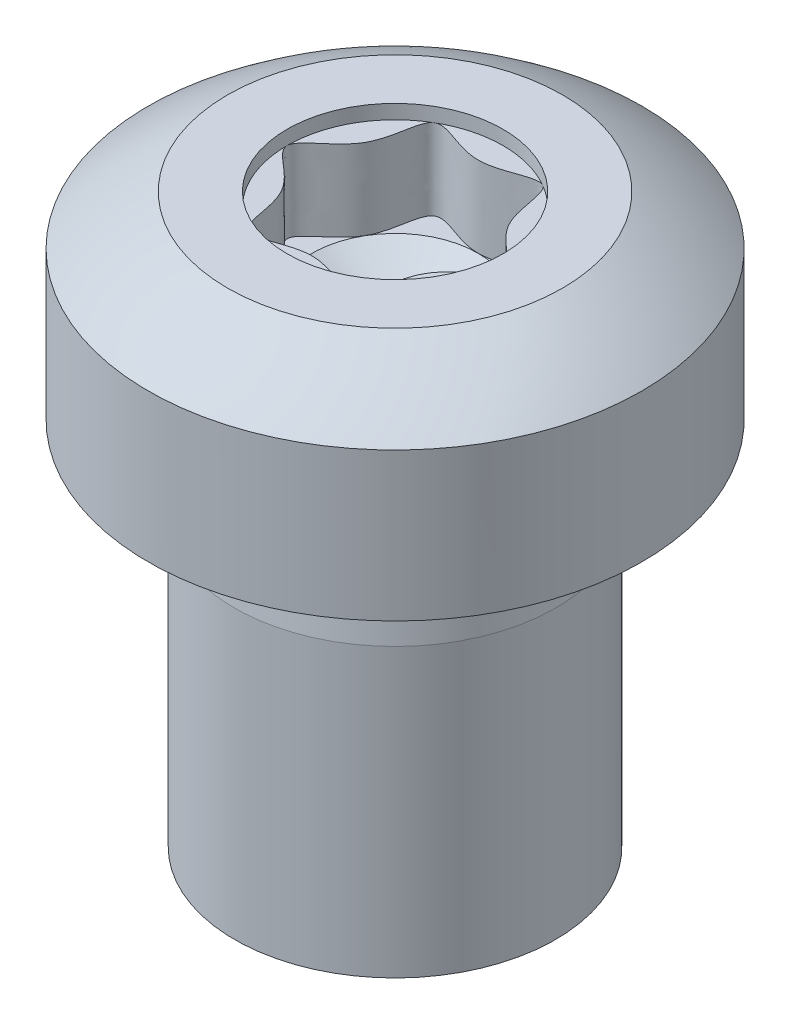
SolidWorks part; units mm, degrees
ref_plane "Front" through (0, 0, 0) normal (0, 0, 1) x (1, 0, 0)
ref_plane "Top" through (0, 0, 0) normal (0, 1, 0) x (1, 0, 0)
ref_plane "Right" through (0, 0, 0) normal (1, 0, 0) x (0, 0, -1)
sketch "Sketch1" plane through (0, 0, 0) normal (0, 0, 1) x (1, 0, 0)
  line L0 (0, 0) -> (0, 34.6184) construction
  line L1 (0, 0) -> (1.3, 0)
  line L2 (1.3, 0) -> (1.3, 3)
  line L3 (1.3, 3) -> (2, 3)
  line L4 (2, 3) -> (2, 4.6)
  line L5 (2, 4.6) -> (0, 4.6)
  line L6 (0, 4.6) -> (0, 0)
  line L7 (2, 3) -> (2.4, 3) construction
  line L8 (2.4, 3) -> (2.4, 0.8) construction
  dimension "HEAD_DIA" = 4
  dimension "HEAD_HT" = 1.6
  dimension "LENGTH" = 3
  dimension "DIA" = 2.6
  dimension "pitch" = 0.4
  dimension "thread_length" = 2.2
revolve "BODY" add sketch "Sketch1" angle 360 about L0
sketch "Sketch2" plane through (0, 0, 0) normal (0, 0, 1) x (1, 0, 0)
  line L0 (2, 4.2) -> (0, 1.702) construction
  line L3 (2, 3) -> (2, 4.6) construction
  line L4 (0, 0) -> (0, 34.6184) construction
  line L5 (0, 4.902) -> (0, 5.3842)
  line L6 (3.2, 1.702) -> (3.2, 5.3842)
  line L7 (3.2, 5.3842) -> (0, 5.3842)
  line L8 (0, 5.3842) -> (3.2, 5.3842)
  arc A0 (3.2, 1.702) -> (0, 4.902) centre (0, 1.702) ccw
  dimension "D1" = 0.4
  dimension "SPHERE_DIA" = 3.2
  dimension "D2" = 0.4822
revolve "HEAD-CUT" cut sketch "Sketch2" angle 360 about axis through (0, 0, 0) along (0, 1, 0)
sketch "Sketch4" plane through (0, 0, 0) normal (0, 0, 1) x (1, 0, 0)
  line L0 (-1.3, 2.3264) -> (-1.2436, 2.9)
  line L1 (-1.3, 3) -> (-1.3, 0) construction
  line L2 (-1.3, 3) -> (-1.3, 2.3264)
  arc A0 (-1.2436, 2.9) -> (-1.3, 3) centre (-1.3431, 2.9098) ccw
  dimension "D1" = 0.1
  dimension "CONER_RAD" = 0.1
  dimension "GAP" = 0.6736
revolve "GAP" cut sketch "Sketch4" angle 360 about axis through (0, 0, 0) along (0, 1, 0)
sketch "Sketch5" plane through (0, 4.6, 0) normal (0, 1, 0) x (-1, 0, 0)
  line L0 (0, 0.6731) -> (0, 0) construction
  line L1 (0, 0) -> (0.4375, 0.7578) construction
  circle A0 centre (0, 0) radius 0.6731 construction
  circle A1 centre (0, 0) radius 0.875
  spline S0 degree 3 poles (0, 0.5431) (0.5387, 0.933) (0.4704, 0.2716) (1.0773, 0) (0.4704, -0.2716) (0.5387, -0.933) (0, -0.5431) (-0.5387, -0.933) (-0.4704, -0.2716) (-1.0773, 0) (-0.4704, 0.2716) (-0.5387, 0.933) (0, 0.5431) (0.5387, 0.933) (0.4704, 0.2716) knots -0.25 -0.166667 -0.083333 0 0.083333 0.166667 0.25 0.333333 0.416667 0.5 0.583333 0.666667 0.75 0.833333 0.916667 1 1.083333 1.166667 1.25 only from (0.4375, 0.7578) to (0.4375, 0.7578)
  point P4 (0, 0.6731)
  point P5 (0.4375, 0.7578)
  point P9 (0.875, 0)
  point P10 (0.5829, 0.3365)
  point P11 (0.5829, -0.3365)
  point P12 (0, -0.6731)
  point P13 (-0.5829, -0.3365)
  point P14 (-0.5829, 0.3365)
  point P15 (0.4375, -0.7578)
  point P16 (-0.4375, -0.7578)
  point P19 (-0.875, 0)
  point P20 (-0.4375, 0.7578)
  dimension "slot_dia" = 1.75
  dimension "D3" = 1.3462
  dimension "D1" = 30
extrude "Recess-Cut-Extrude1" cut sketch "Sketch5" against normal blind 0.77
sketch "Sketch3" plane through (0, 0, 0) normal (0, 0, 1) x (1, 0, 0)
  line L0 (0, 3.4414) -> (0.6731, 3.83)
  line L1 (0, 0) -> (0, 34.6184) construction
  line L2 (0.6731, 3.83) -> (0, 3.83)
  line L3 (0, 3.83) -> (0, 3.4414)
  dimension "D1" = 60
  dimension "DRILL_RAD" = 0.6731
  dimension "SLOT_DEP" = 0.77
revolve "DRILL-CUT" cut sketch "Sketch3" angle 360 about axis through (0, 0, 0) along (0, 1, 0)
sketch "Sketch6" plane through (0, 0, 0) normal (0, 0, 1) x (1, 0, 0)
  line L0 (1.3, 0) -> (1.0835, 0.125)
  line L1 (1.0835, 0.125) -> (1.3, 0.25)
  line L4 (1.3, 0.25) -> (1.3, 0)
  line L5 (0, 0) -> (0, 34.6184) construction
  dimension "D1" = 1.0835
revolve "ThreadSchematic" [suppressed] cut sketch "Sketch6" angle 360 about axis through (0, 0, 0) along (0, 1, 0)
pattern_linear "ThdSchPat" [suppressed] count 6 spacing 0.4 along (0, 1, 0)
sketch "Sketch7" plane through (0, 4.6, 0) normal (0, 1, 0) x (-1, 0, 0)
  circle A0 centre (0, 0) radius 0.875
  dimension "D1" = 1.75
extrude "Recess-Cut-Extrude2" cut sketch "Sketch7" against normal blind 0.1155
equation "\"D1@Sketch2\" = \"HEAD_HT@Sketch1\" * 0.25"
equation "\"D1@Sketch4\" = \"CONER_RAD@Sketch4\""
equation "\"D1@Recess-Cut-Extrude1\" = \"SLOT_DEP@Sketch3\""
equation "\"D1@Sketch7\" = \"slot_dia@Sketch5\""
equation "\"D1@Recess-Cut-Extrude2\" = \"SLOT_DEP@Sketch3\" * 0.15"
equation "\"D3@Sketch5\" = \"slot_dia@Sketch5\" / 1.3"
equation "\"DRILL_RAD@Sketch3\" = \"D3@Sketch5\" * 0.5"
equation "\"D1@ThreadCosmetic\" = \"thread_length@Sketch1\""
equation "\"D2@ThreadCosmetic\" = \"DIA@Sketch1\" - 1.0825 * \"pitch@Sketch1\""
equation "\"D1@Sketch6\" = \"D2@ThreadCosmetic\" / 2"
equation "\"D3@ThdSchPat\" = \"pitch@Sketch1\""
equation "\"D1@ThdSchPat\" = \"thread_length@Sketch1\" / \"pitch@Sketch1\""
